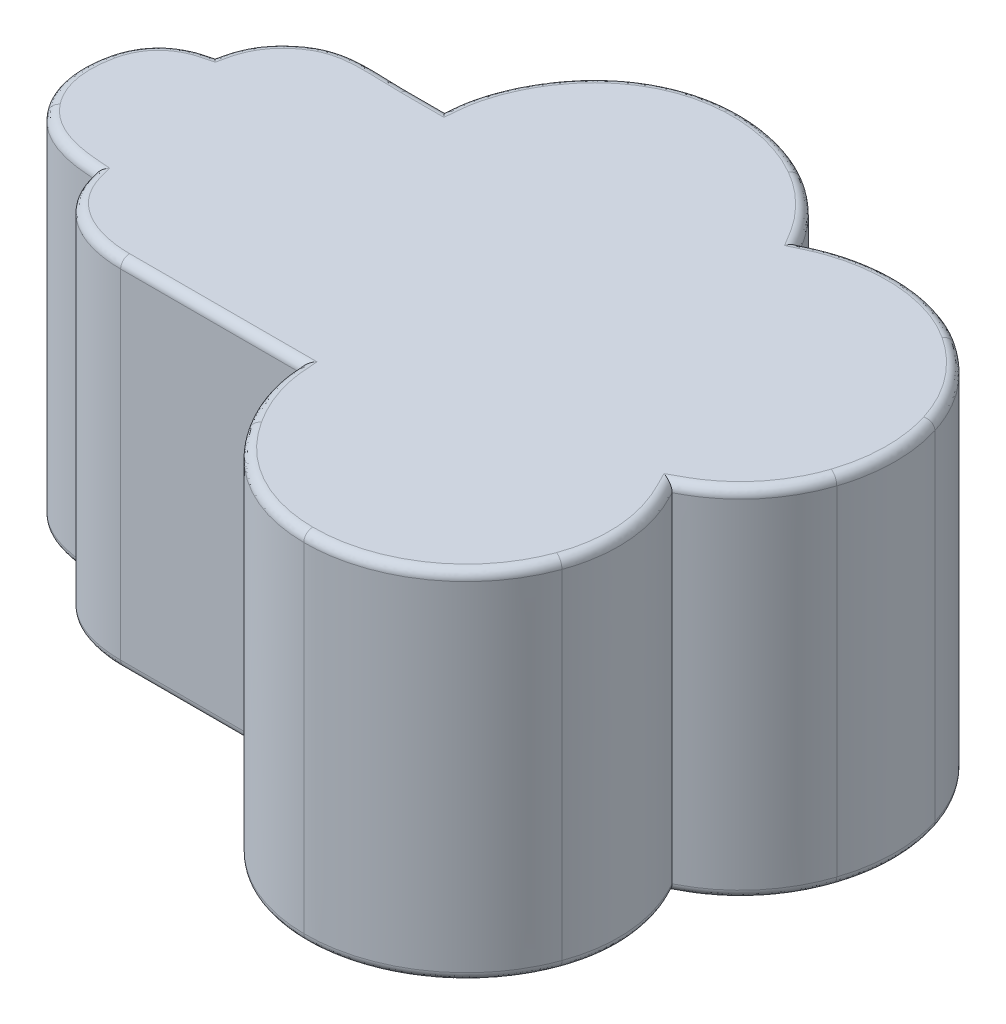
SolidWorks part; units mm, degrees
ref_plane "Front Plane" through (0, 0, 0) normal (0, 0, 1) x (1, 0, 0)
ref_plane "Top Plane" through (0, 0, 0) normal (0, 1, 0) x (1, 0, 0)
ref_plane "Right Plane" through (0, 0, 0) normal (1, 0, 0) x (0, 0, -1)
body saved out of another part "Stock-Wooden Clock Video-1"
fillet "Fillet1" radius 0.5 42 edges
